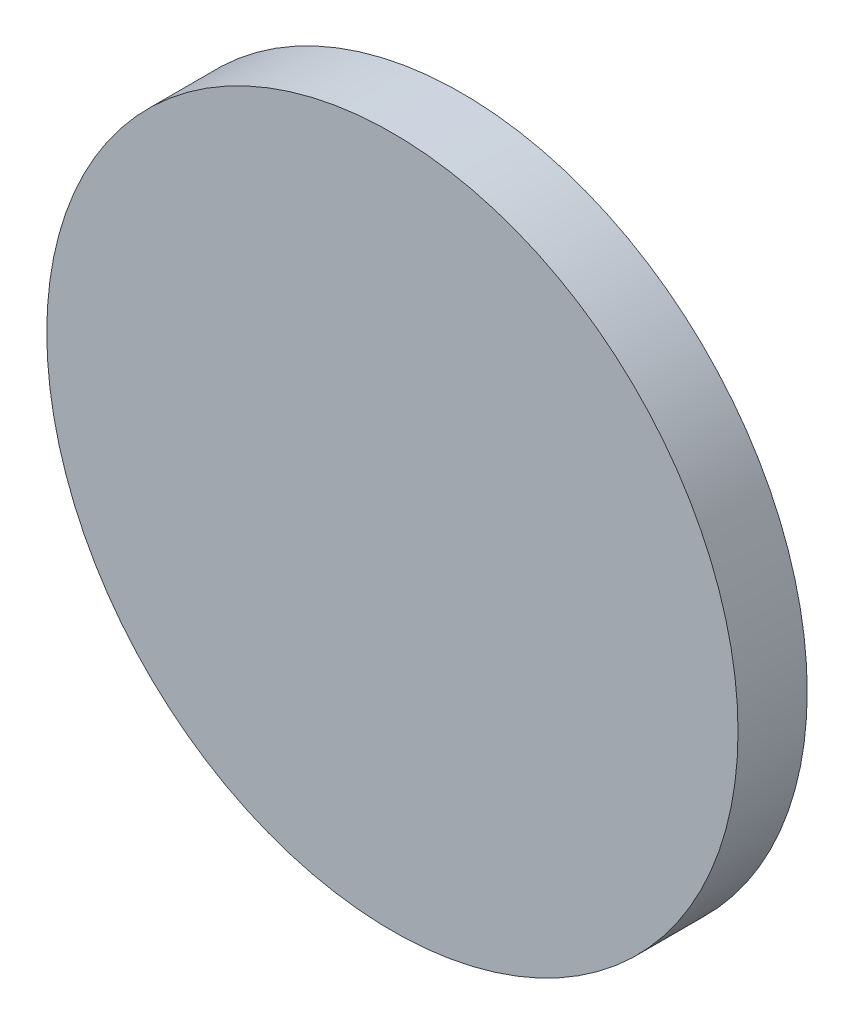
SolidWorks part; units mm, degrees
ref_plane "Ebene vorne" through (0, 0, 0) normal (0, 0, 1) x (1, 0, 0)
ref_plane "Ebene oben" through (0, 0, 0) normal (0, 1, 0) x (1, 0, 0)
ref_plane "Ebene rechts" through (0, 0, 0) normal (1, 0, 0) x (0, 0, -1)
sketch "Skizze1" plane through (0, 0, 0) normal (0, 0, 1) x (1, 0, 0)
  circle A0 centre (-13.8764, 74.7597) radius 49.9486
extrude "Aufsatz-Linear austragen1" add sketch "Skizze1" along normal blind 10
